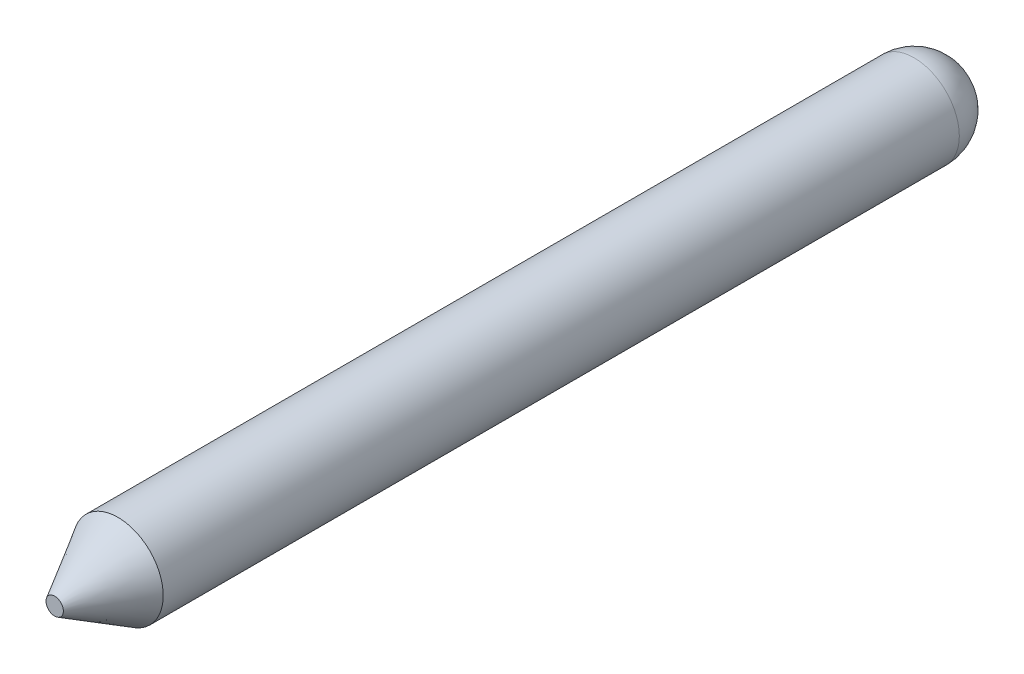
SolidWorks part; units mm, degrees
ref_plane "Front" through (0, 0, 0) normal (0, 0, 1) x (1, 0, 0)
ref_plane "Top" through (0, 0, 0) normal (0, 1, 0) x (1, 0, 0)
ref_plane "Right" through (0, 0, 0) normal (1, 0, 0) x (0, 0, -1)
sketch "Sketch1" plane through (0, 0, 0) normal (0, 0, 1) x (1, 0, 0)
  circle A0 centre (0, 0) radius 5
  dimension "D1" = 10
extrude "Base-Extrude" add sketch "Sketch1" along normal blind 100
fillet "Fillet1" radius 5 1 edges at (5, 0, 0)
chamfer "Chamfer1" distance 7 angle 30 1 edges at (5, 0, 100)
